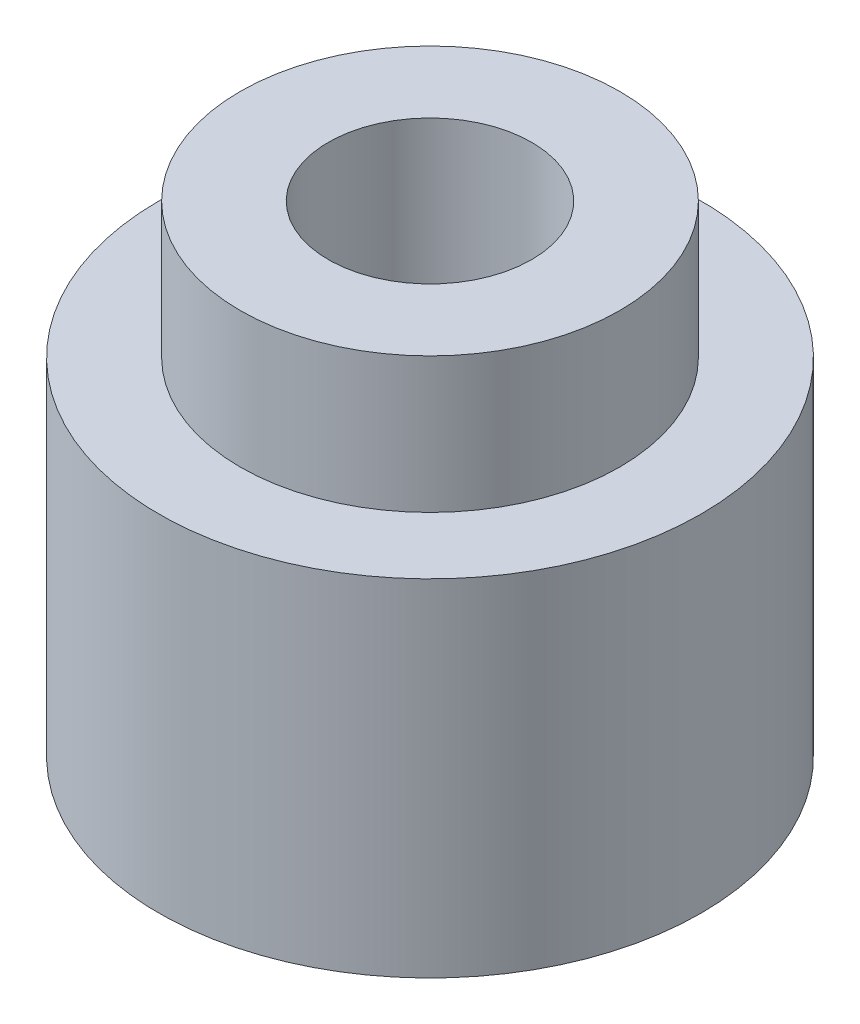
SolidWorks part; units mm, degrees
ref_plane "Plan de face" through (0, 0, 0) normal (0, 0, 1) x (1, 0, 0)
ref_plane "Plan de dessus" through (0, 0, 0) normal (0, 1, 0) x (1, 0, 0)
ref_plane "Plan de droite" through (0, 0, 0) normal (1, 0, 0) x (0, 0, -1)
imported_body "Importée1"
sketch "Esquisse1" plane through (0, 1.2113, 0) normal (0, 1, 0) x (1, 0, 0)
  circle A0 centre (0, 0) radius 3
  circle A1 centre (0, 0) radius 2.8
  dimension "D1" = 0.2
  dimension "D2" = 6
extrude "Enlèv. mat.-Extru.1" cut sketch "Esquisse1" against normal up to surface (2 mm away)
